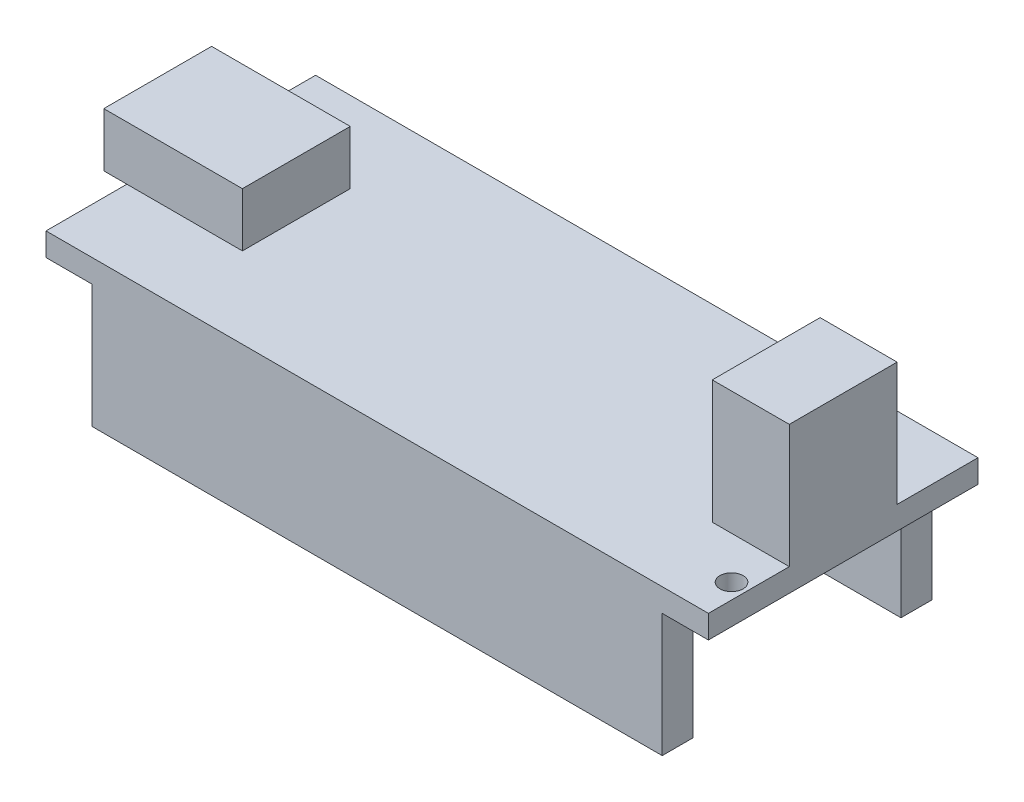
SolidWorks part; units mm, degrees
ref_plane "Front Plane" through (0, 0, 0) normal (0, 0, 1) x (1, 0, 0)
ref_plane "Top Plane" through (0, 0, 0) normal (0, 1, 0) x (1, 0, 0)
ref_plane "Right Plane" through (0, 0, 0) normal (1, 0, 0) x (0, 0, -1)
sketch "Sketch1" plane through (0, 0, 0) normal (0, 1, 0) x (1, 0, 0)
  line L1 (21.5, -8.75) -> (-21.5, -8.75)
  line L2 (21.5, -8.75) -> (21.5, 8.75)
  line L3 (21.5, 8.75) -> (-21.5, 8.75)
  line L4 (-21.5, -8.75) -> (-21.5, 8.75)
  line L5 (21.5, -8.75) -> (-21.5, 8.75) construction
  line L6 (21.5, 8.75) -> (-21.5, -8.75) construction
  circle A0 centre (20.5, -6.25) radius 0.75
  point P0 (0, 0)
  dimension "D3" = 1.5
  dimension "D4" = 1
  dimension "D1" = 17.5
  dimension "D2" = 43
  dimension "D5" = 2.5
extrude "Boss-Extrude1" add sketch "Sketch1" along normal blind 1.5
sketch "Sketch2" plane through (0, 1.5, 0) normal (0, 1, 0) x (1, 0, 0)
  line L0 (-21.5, 8.75) -> (-21.5, -8.75) construction
  line L1 (-23, 3.5) -> (-14, 3.5)
  line L2 (-23, 3.5) -> (-23, -3.5)
  line L3 (-23, -3.5) -> (-14, -3.5)
  line L4 (-14, 3.5) -> (-14, -3.5)
  point P6 (-21.5, 0)
  point P7 (-23, 0)
  dimension "D1" = 9
  dimension "D2" = 7
  dimension "D3" = 1.5
extrude "Boss-Extrude2" add sketch "Sketch2" along normal blind 3.5
sketch "Sketch3" plane through (0, 1.5, 0) normal (0, 1, 0) x (1, 0, 0)
  line L0 (21.5, -8.75) -> (21.5, 8.75) construction
  line L1 (21.5, 3.5) -> (16.5, 3.5)
  line L2 (21.5, 3.5) -> (21.5, -3.5)
  line L3 (21.5, -3.5) -> (16.5, -3.5)
  line L4 (16.5, 3.5) -> (16.5, -3.5)
  point P6 (21.5, 0)
  point P7 (21.5, 0)
  dimension "D1" = 5
  dimension "D2" = 7
extrude "Boss-Extrude3" add sketch "Sketch3" along normal blind 8
sketch "Sketch4" plane through (0, 0, 0) normal (0, -1, 0) x (1, 0, 0)
  line L0 (-21.5, 8.75) -> (21.5, 8.75) construction
  line L1 (-18.5, 8.75) -> (18.5, 8.75)
  line L2 (-18.5, 8.75) -> (-18.5, 6.75)
  line L3 (-18.5, 6.75) -> (18.5, 6.75)
  line L4 (18.5, 8.75) -> (18.5, 6.75)
  line L5 (5.225, 0) -> (-5.225, 0) construction
  line L6 (-18.5, -6.75) -> (18.5, -6.75)
  line L7 (18.5, -8.75) -> (18.5, -6.75)
  line L8 (-18.5, -8.75) -> (18.5, -8.75)
  line L9 (-18.5, -8.75) -> (-18.5, -6.75)
  point P6 (0, 8.75)
  dimension "D1" = 37
  dimension "D2" = 2
extrude "Boss-Extrude4" add sketch "Sketch4" along normal blind 8
